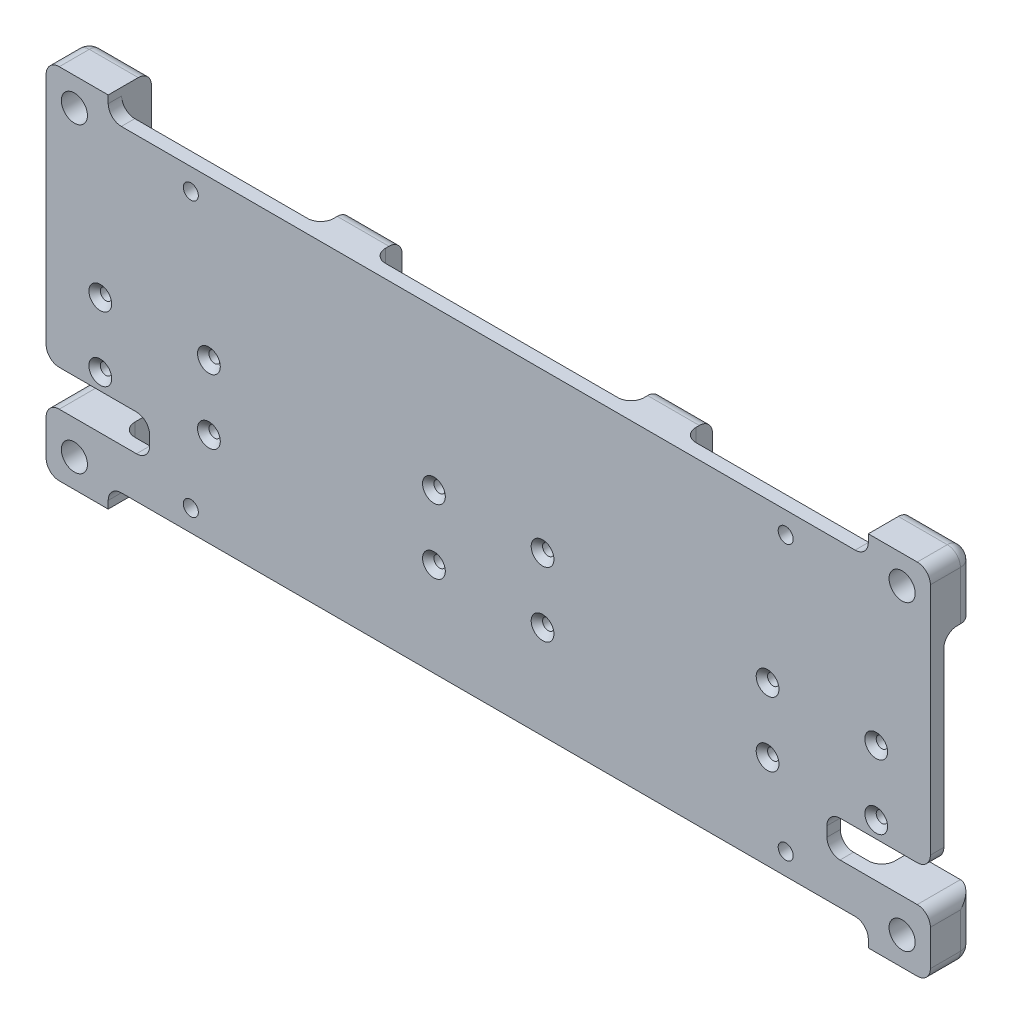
SolidWorks part; units mm, degrees
ref_plane "Front Plane" through (0, 0, 0) normal (0, 0, 1) x (1, 0, 0)
ref_plane "Top Plane" through (0, 0, 0) normal (0, 1, 0) x (1, 0, 0)
ref_plane "Right Plane" through (0, 0, 0) normal (1, 0, 0) x (0, 0, -1)
sketch "Sketch1" plane through (0, 0, 0) normal (0, 0, 1) x (1, 0, 0)
  line L51 (-85.47, -34.67) -> (85.47, -34.67)
  line L52 (-85.47, -34.67) -> (-85.47, 34.67)
  line L53 (-85.47, 34.67) -> (85.47, 34.67)
  line L54 (85.47, -34.67) -> (85.47, 34.67)
  line L55 (-85.47, -34.67) -> (85.47, 34.67) construction
  line L56 (-85.47, 34.67) -> (85.47, -34.67) construction
  line L57 (-112.7404, 0) -> (103.6315, 0) construction
  line L65 (0, 45.9493) -> (0, -39.7473) construction
  line L74 (-73.47, -30.67) -> (73.47, -30.67)
  line L75 (-73.47, 34.67) -> (73.47, 34.67)
  line L76 (-73.47, 34.67) -> (-73.47, 30.67)
  line L77 (-73.47, 30.67) -> (73.47, 30.67)
  line L78 (73.47, 34.67) -> (73.47, 30.67)
  line L79 (73.47, -34.67) -> (73.47, -30.67)
  line L80 (-73.47, -34.67) -> (73.47, -34.67)
  line L81 (-73.47, -34.67) -> (-73.47, -30.67)
  circle A0 centre (-57.5, 26.5) radius 1.45
  circle A1 centre (-57.5, -26.5) radius 1.45
  circle A2 centre (57.5, 26.5) radius 1.45
  circle A3 centre (57.5, -26.5) radius 1.45
  point P0 (0, 0)
extrude "Boss-Extrude1" add sketch "Sketch1" along normal blind 2.6
sketch "Sketch8" plane through (0, 0, 0) normal (0, 0, 1) x (1, 0, 0)
  line L0 (80, 0) -> (-70, 0) construction
  line L3 (0, 34.67) -> (0, -29) construction
  line L6 (-70, -6.25) -> (80, -6.25) construction
  circle A0 centre (75, 0) radius 2.5
  circle A1 centre (54, 0) radius 2.5
  circle A2 centre (10.5, 0) radius 2.5
  circle A3 centre (-10.5, 0) radius 2.5
  circle A4 centre (-54, 0) radius 2.5
  circle A5 centre (-75, 0) radius 2.5
  circle A12 centre (75, -12.5) radius 2.5
  circle A13 centre (54, -12.5) radius 2.5
  circle A14 centre (10.5, -12.5) radius 2.5
  circle A15 centre (-10.5, -12.5) radius 2.5
  circle A16 centre (-54, -12.5) radius 2.5
  circle A17 centre (-75, -12.5) radius 2.5
  dimension "D1" = 5
  dimension "D4" = 5
  dimension "D6" = 5
  dimension "D2" = 75
  dimension "D3" = 0
  dimension "D5" = 21
  dimension "D7" = 10.5
  dimension "D8" = 6.25
extrude "Boss-Extrude2" add sketch "Sketch8" against normal blind 2.25
hole_wizard "CSK for M2 Flat Head Machine Screw1" positions "Sketch9" profile "Sketch10" countersink size "M2" standard "ANSI Metric"
sketch "Sketch9" plane through (0, 0, 2.6) normal (0, 0, 1) x (1, 0, 0)
  point P0 (-75, 0)
  point P3 (-75, -12.5)
  point P6 (-54, 0)
  point P11 (-10.5, 0)
  point P14 (-10.5, -12.5)
  point P16 (10.5, 0)
  point P19 (10.5, -12.5)
  point P22 (54, 0)
  point P25 (54, -12.5)
  point P28 (75, 0)
  point P31 (75, -12.5)
  point P35 (-54, -12.5)
sketch "Sketch10" plane through (-75, 0, 2.6) normal (1, 0, 0) x (0, -1, 0)
  line L0 (0, 0) -> (0, 6.6609)
  line L1 (0, 6.6609) -> (1.1, 6)
  line L2 (1.1, 6) -> (1.1, 1.1)
  line L3 (1.1, 1.1) -> (2.2, 0)
  line L5 (2.2, 0) -> (0, 0)
  line L6 (-1.1, 1.1) -> (-2.2, 0) construction
  line L10 (0, 6.6609) -> (-1.1, 6) construction
  line L11 (0, -6.35) -> (0, 107.95) construction
  dimension "Hole Dia." = 2.2
  dimension "Hole Depth" = 6
  dimension "Near C'Sink Dia." = 4.4
  dimension "Near C'Sink Angle" = 90
  dimension "Drill Angle" = 118
sketch "Sketch14" plane through (0, 0, 0) normal (0, 0, 1) x (1, 0, 0)
  line L0 (92.3624, 0) -> (-110.086, 0) construction
  line L1 (73.47, 34.67) -> (85.47, 34.67)
  line L2 (73.47, 34.67) -> (73.47, 22.67)
  line L3 (73.47, 22.67) -> (85.47, 22.67)
  line L4 (85.47, 34.67) -> (85.47, 22.67)
  line L5 (-73.47, 22.67) -> (-85.47, 22.67)
  line L6 (-85.47, 34.67) -> (-85.47, 22.67)
  line L7 (0, 61.7829) -> (0, -56.9152) construction
  line L8 (-73.47, 34.67) -> (-85.47, 34.67)
  line L9 (-73.47, 34.67) -> (-73.47, 22.67)
  line L10 (-73.47, -34.67) -> (-73.47, -22.67)
  line L11 (-73.47, -34.67) -> (-85.47, -34.67)
  line L12 (-85.47, -34.67) -> (-85.47, -22.67)
  line L13 (-73.47, -22.67) -> (-85.47, -22.67)
  line L14 (73.47, -22.67) -> (85.47, -22.67)
  line L15 (85.47, -34.67) -> (85.47, -22.67)
  line L16 (73.47, -34.67) -> (85.47, -34.67)
  line L17 (73.47, -34.67) -> (73.47, -22.67)
  line L18 (-73.47, 30.67) -> (73.47, 30.67) construction
  line L19 (35, 30.67) -> (25, 30.67)
  line L20 (35, 30.67) -> (35, 20.67)
  line L21 (35, 20.67) -> (25, 20.67)
  line L22 (25, 30.67) -> (25, 20.67)
  line L23 (-35, 20.67) -> (-25, 20.67)
  line L24 (-25, 30.67) -> (-25, 20.67)
  line L25 (-35, 30.67) -> (-25, 30.67)
  line L26 (-35, 30.67) -> (-35, 20.67)
  line L27 (-35, -30.67) -> (-35, -20.67)
  line L28 (-35, -30.67) -> (-25, -30.67)
  line L29 (-25, -30.67) -> (-25, -20.67)
  line L30 (-35, -20.67) -> (-25, -20.67)
  line L31 (35, -20.67) -> (25, -20.67)
  line L32 (25, -30.67) -> (25, -20.67)
  line L33 (35, -30.67) -> (25, -30.67)
  line L34 (35, -30.67) -> (35, -20.67)
  dimension "D1" = 10
  dimension "D2" = 10
  dimension "D3" = 25
extrude "Boss-Extrude3" add sketch "Sketch14" against normal blind 5.75
hole_wizard "#8 (0.199) Diameter Hole1" positions "Sketch15" profile "Sketch16" hole size "#8" standard "ANSI Inch"
sketch "Sketch15" plane through (0, 0, 2.6) normal (0, 0, 1) x (1, 0, 0)
  line L0 (0, 42.1448) -> (0, -49.6168) construction
  line L2 (-88.4844, 0) -> (87.3046, 0) construction
  point P0 (-80.01, 29.21)
  point P2 (80.01, 29.21)
  point P4 (80.01, -29.21)
  point P6 (-80.01, -29.21)
sketch "Sketch16" plane through (-80.01, 29.21, 2.6) normal (1, 0, 0) x (0, -1, 0)
  line L0 (0, 0) -> (0, 12.2286)
  line L1 (0, 12.2286) -> (2.5273, 10.71)
  line L2 (2.5273, 10.71) -> (2.5273, 0)
  line L5 (2.5273, 0) -> (0, 0)
  line L10 (0, 12.2286) -> (-2.5273, 10.71) construction
  line L11 (0, -6.35) -> (0, 107.95) construction
  dimension "Hole Dia." = 5.0546
  dimension "Hole Depth" = 10.71
  dimension "Drill Angle" = 118
sketch "Sketch17" plane through (0, 0, 0) normal (0, 0, 1) x (1, 0, 0)
  line L0 (0, 48.7271) -> (0, -54.8293) construction
  line L1 (85.47, -22.67) -> (85.47, 22.67) construction
  line L2 (85.47, -15.67) -> (65.47, -15.67)
  line L3 (85.47, -15.67) -> (85.47, -22.67)
  line L4 (85.47, -22.67) -> (65.47, -22.67)
  line L5 (65.47, -15.67) -> (65.47, -22.67)
  line L7 (-85.47, -22.67) -> (-65.47, -22.67)
  line L8 (-65.47, -15.67) -> (-65.47, -22.67)
  line L9 (-85.47, -15.67) -> (-65.47, -15.67)
  line L10 (-85.47, -15.67) -> (-85.47, -22.67)
  line L12 (73.47, -34.67) -> (85.47, -34.67) construction
  dimension "D1" = 20
  dimension "D2" = 7
  dimension "D3" = 12
extrude "Cut-Extrude2" cut sketch "Sketch17" along normal through all
fillet "Fillet9" radius 2.54 42 edges at (65.47, -22.67, 1.3) (65.47, -15.67, 1.3) (85.47, -15.67, 1.3) (85.47, -22.67, -1.575) (-85.47, -22.67, -1.575) (-65.47, -22.67, 1.3) (-65.47, -15.67, 1.3) (-85.47, -15.67, 1.3) (-85.47, -34.67, -1.575) (-85.47, -28.67, -5.75) (-79.47, -34.67, -5.75) (30, -30.67, -5.75) (-30, -30.67, -5.75) (30, 30.67, -5.75) (-30, 30.67, -5.75) (-85.47, 34.67, -1.575) (-85.47, 28.67, -5.75) (-79.47, 34.67, -5.75) (85.47, -34.67, -1.575) (79.47, -34.67, -5.75) (85.47, -28.67, -5.75) (85.47, 28.67, -5.75) (85.47, 34.67, -1.575) (79.47, 34.67, -5.75) (-73.47, 30.67, 1.3) (-73.47, -30.67, 1.3) (73.47, -30.67, 1.3) (73.47, 30.67, 1.3) (-79.47, 22.67, 0) (-35, -25.67, 0) (-30, -20.67, 0) (-25, -25.67, 0) (25, -25.67, 0) (30, -20.67, 0) (35, -25.67, 0) (-35, 25.67, 0) (-30, 20.67, 0) (-25, 25.67, 0) (25, 25.67, 0) (30, 20.67, 0) (35, 25.67, 0) (79.47, 22.67, 0)
fillet "Fillet10" radius 2.54 2 edges at (-73.47, -27.94, 0) (73.47, -27.94, 0)
fillet "Fillet8" radius 2.54
equation "\"D8@Sketch1\"=\"D7@Sketch1\""
equation "\"D4@Sketch15\"=\"D1@Sketch15\""
